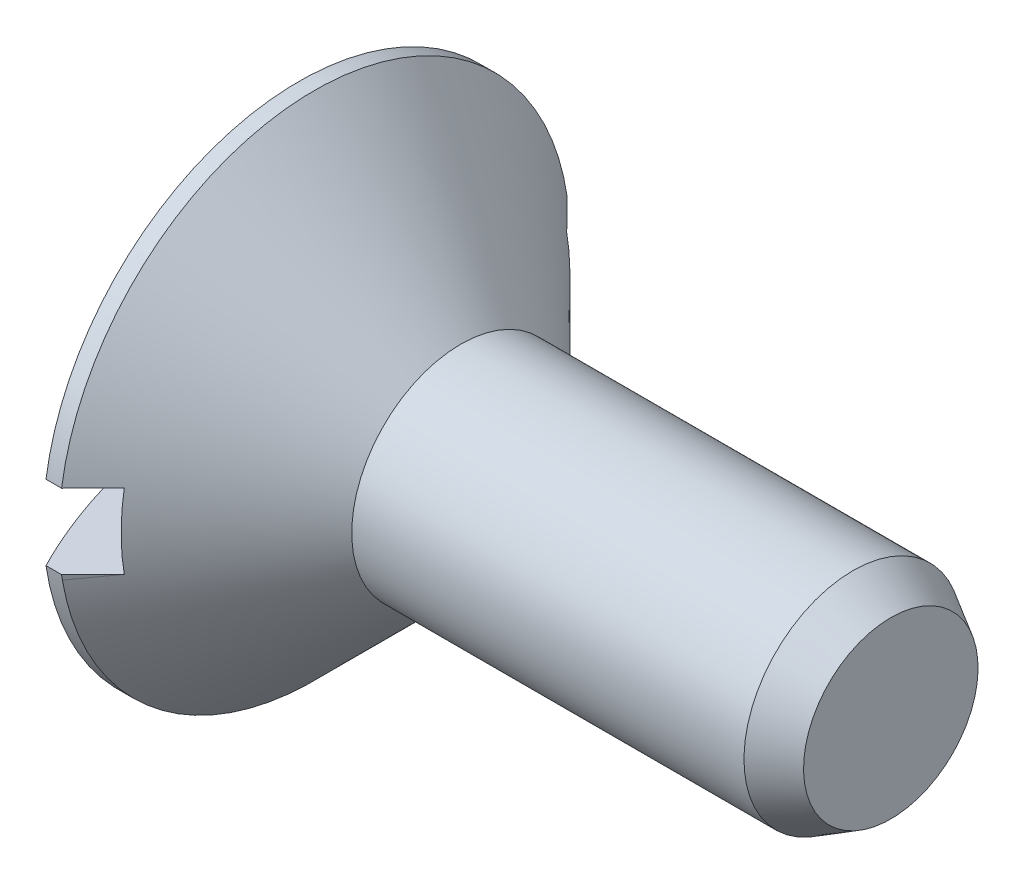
SolidWorks part; units mm, degrees
ref_plane "Front" through (0, 0, 0) normal (0, 0, 1) x (1, 0, 0)
ref_plane "Top" through (0, 0, 0) normal (0, 1, 0) x (1, 0, 0)
ref_plane "Right" through (0, 0, 0) normal (1, 0, 0) x (0, 0, -1)
sketch "Sketch1" plane through (0, 0, 0) normal (0, 0, 1) x (1, 0, 0)
  line L0 (0, 4.1) -> (0.25, 4.1)
  line L1 (0.25, 4.1) -> (2.6, 1.75)
  line L2 (2.6, 1.75) -> (9.5, 1.75)
  line L3 (9.5, 1.75) -> (9.5, 0)
  line L4 (9.5, 0) -> (0, 0)
  line L5 (0, 0) -> (0, 4.1) construction
  line L6 (6.6207, 0) -> (-1, 0) construction
  line L7 (-1, 0) -> (-1, -0.1422) construction
  line L8 (0, 0) -> (-1, 0)
  arc A1 (0, 4.1) -> (-1, 0) centre (7.905, 0) ccw
  dimension "D1" = 45
  dimension "d" = 3.5
  dimension "dK" = 8.2
  dimension "k" = 2.6
  dimension "l" = 9.5
  dimension "f" = 1
revolve "Revolve1" add sketch "Sketch1" angle 360 about L6
sketch "Sketch2" plane through (0, 0, 0) normal (0, 0, 1) x (1, 0, 0)
  line L1 (-1, 0.6) -> (0.75, 0.6)
  line L2 (-1, 0.6) -> (-1, -0.6)
  line L3 (-1, -0.6) -> (0.75, -0.6)
  line L4 (0.75, 0.6) -> (0.75, -0.6)
  line L5 (0, 0) -> (-1, 0) construction
  arc A0 (0, 4.1) -> (-1, 0) centre (7.905, 0) ccw construction
  dimension "n" = 1.2
  dimension "t" = 1.75
extrude "Cut-Extrude1" cut sketch "Sketch2" against normal through all and the other way through all
chamfer "Chamfer1" distance 0.35 angle 60 1 edges at (9.5, 1.75, 0)
sketch "Sketch4" plane through (0, 0, 0) normal (0, 0, 1) x (1, 0, 0)
  line L0 (3.0424, 1.6) -> (2.7347, 1.6)
  line L1 (2.7347, 1.6) -> (2.6481, 1.75)
  line L2 (3.0424, 1.6) -> (3.129, 1.75)
  line L3 (2.6481, 1.75) -> (2.6481, 2)
  line L4 (3.129, 1.75) -> (3.129, 2)
  line L5 (2.6481, 2) -> (3.129, 2)
  line L6 (2.8886, 1.6) -> (2.8886, 0) construction
  line L7 (0, 0) -> (7.3035, 0) construction
  line L9 (2.6, 1.75) -> (2.6, -1.75) construction
  line L12 (8.8938, 1.75) -> (2.6, 1.75) construction
  dimension "D2" = 60
  dimension "D3" = 0.25
  dimension "threadstart" = 0.2886
  dimension "minordia" = 3.2
  dimension "advance" = 0.4809
revolve "ThreadSchematic" [suppressed] cut sketch "Sketch4" angle 360 about L7
pattern_linear "ThdSchPat" [suppressed] count 15 spacing 0.4809 along (-1, 0, 0)
sketch "Sketch3" plane through (0, 0, 0) normal (0, 0, 1) x (1, 0, 0)
  line L0 (2.6, 1.75) -> (9.5, 1.75) construction
  line L2 (7.5, 1.75) -> (8, 1.75) construction
  line L3 (9.5, 1.75) -> (9.5, 0) construction
  line L4 (8, 1.75) -> (9.5, 0)
  line L5 (2.9, 0) -> (5.4301, 0) construction
  line L6 (9.5, 0) -> (9.7, 0)
  line L7 (9.7, 0) -> (9.7, 1.75)
  line L8 (9.7, 1.75) -> (9.5, 1.75)
  line L9 (8, 1.75) -> (9.5, 1.75)
  dimension "D1" = 0.5
  dimension "y" = 2
  dimension "D2" = 0.2
revolve "EndCone" [suppressed] cut sketch "Sketch3" angle 360 about L5
equation "\"Minordia@sketch4\" = \"D2@ThreadCosmetic\""
equation "\"D1@Chamfer1\" = \"d@Sketch1\" / 10"
equation "\"D1@Sketch3\" = \"y@Sketch3\" / 4"
equation "\"threadstart@Sketch4\" = \"advance@Sketch4\"*0.6"
equation "\"D1@ThdSchPat\" = int(((\"l@Sketch1\"-\"k@Sketch1\")/\"advance@Sketch4\") + 0.999)"
equation "\"D3@ThdSchPat\" = \"advance@Sketch4\""
